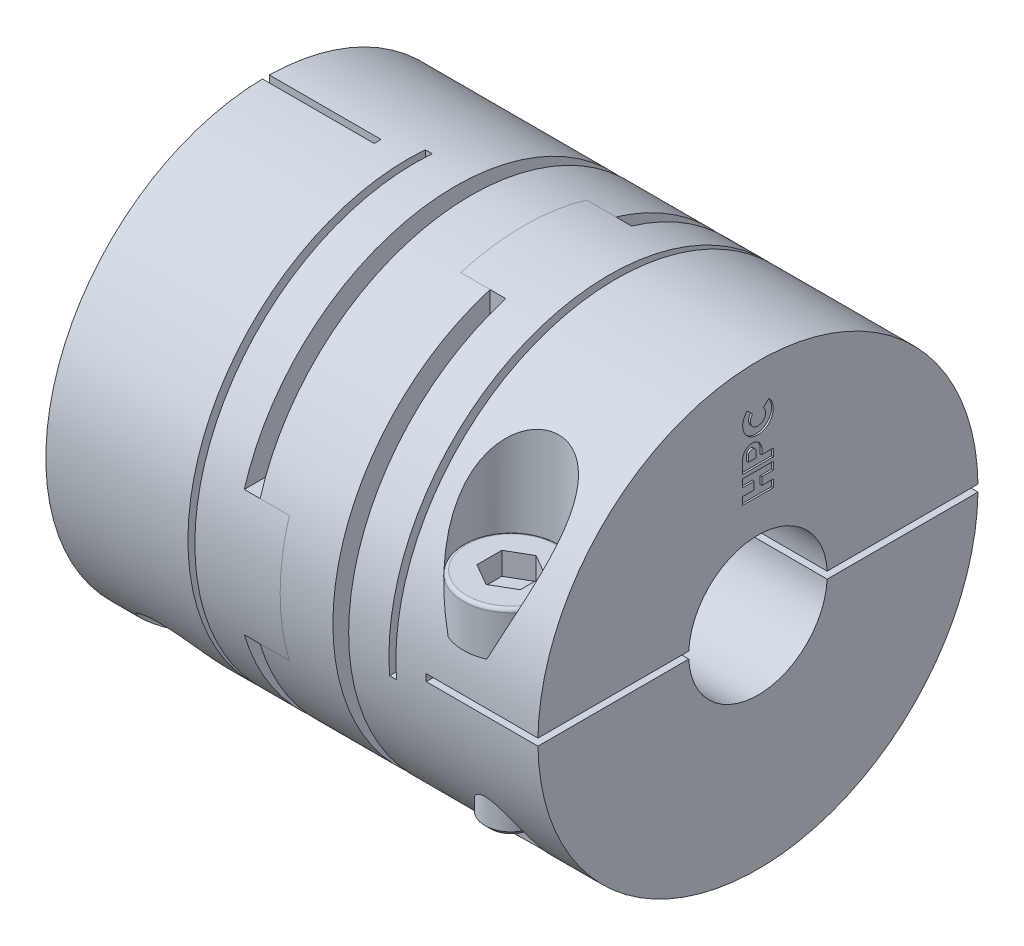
SolidWorks part; units mm, degrees
ref_plane "Front" through (0, 0, 0) normal (0, 0, 1) x (1, 0, 0)
ref_plane "Top" through (0, 0, 0) normal (0, 1, 0) x (1, 0, 0)
ref_plane "Right" through (0, 0, 0) normal (1, 0, 0) x (0, 0, -1)
imported_body "_HPC - BGC256.35-1_1-1-solid1"
imported_body "_HPC - BGC25_2_1-1-solid1"
imported_body "_HPC - BGC258-3-1-solid1"
sketch "Esquisse1" plane through (0, 0, 0) normal (-1, 0, 0) x (0, 0, 1)
  circle A0 centre (0, 0) radius 4
  dimension "D1" = 8
extrude "Enlèv. mat.-Extru.1" cut sketch "Esquisse1" against normal up to surface (8.6 mm away)
